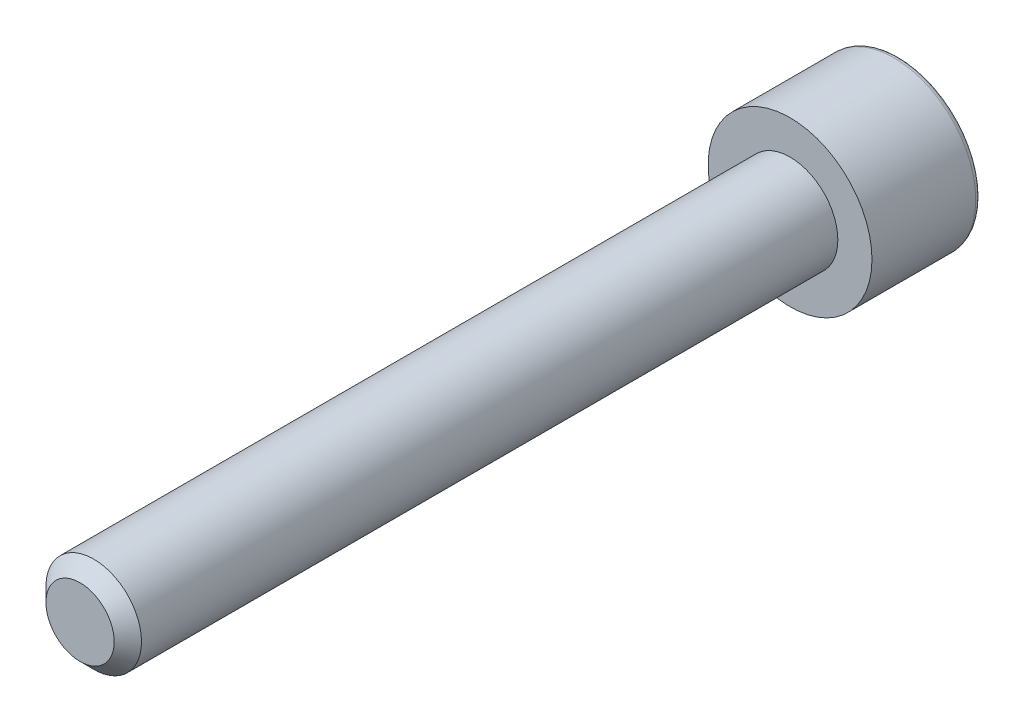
SolidWorks part; units mm, degrees
ref_plane "Plan de face" through (0, 0, 0) normal (0, 0, 1) x (1, 0, 0)
ref_plane "Plan de dessus" through (0, 0, 0) normal (0, 1, 0) x (1, 0, 0)
ref_plane "Plan de droite" through (0, 0, 0) normal (1, 0, 0) x (0, 0, -1)
sketch "Esquisse1" plane through (0, 0, 0) normal (0, 0, 1) x (1, 0, 0)
  circle A0 centre (0, 0) radius 3
  dimension "D1" = 6
extrude "Boss.-Extru.1" add sketch "Esquisse1" along normal blind 30
sketch "Esquisse2" plane through (0, 0, 30) normal (0, 0, 1) x (1, 0, 0)
  circle A0 centre (0, 0) radius 1.75
  dimension "D1" = 3.5
fillet "Congé1" radius 0.2 1 edges at (3, 0, 0)
sketch "Esquisse3" plane through (0, 0, 0) normal (0, 0, -1) x (-1, 0, 0)
  line L0 (-3.4094, 0) -> (3.2032, 0) construction
  line L2 (1.0104, -1.75) -> (2.0207, 0)
  line L3 (2.0207, 0) -> (1.0104, 1.75)
  line L4 (1.0104, 1.75) -> (-1.0104, 1.75)
  line L5 (-1.0104, 1.75) -> (-2.0207, 0)
  line L6 (-2.0207, 0) -> (-1.0104, -1.75)
  line L7 (-1.0104, -1.75) -> (1.0104, -1.75)
  circle A0 centre (0, 0) radius 1.75 construction
  dimension "D1" = 3.5
  dimension "D2" = 2.0207
extrude "Enlèv. mat.-Extru.2" cut sketch "Esquisse3" against normal blind 3.5
fillet "Congé2" radius 0.2 6 edges at (-1.5155, -0.875, 3.5) (-1.5155, 0.875, 3.5) (0, 1.75, 3.5) (0, -1.75, 3.5) (1.5155, -0.875, 3.5) (1.5155, 0.875, 3.5)
extrude "Enlèv. mat.-Extru.3" cut sketch "Esquisse2" against normal blind 26 flip side to cut
chamfer "Chanfrein1" distance 0.5 angle 45 1 edges at (1.75, 0, 30)
